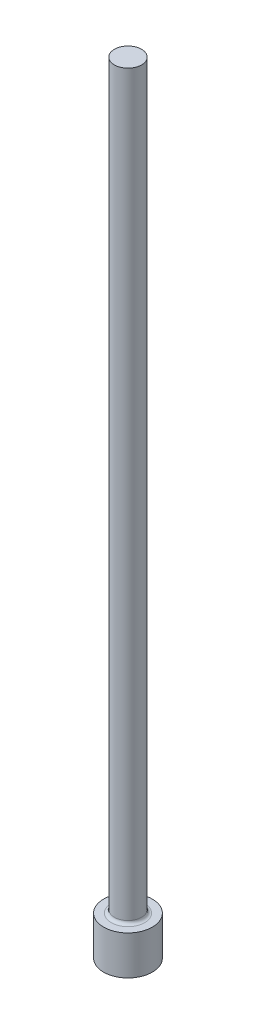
SolidWorks part; units mm, degrees
ref_plane "Front Plane" through (0, 0, 0) normal (0, 0, 1) x (1, 0, 0)
ref_plane "Top Plane" through (0, 0, 0) normal (0, 1, 0) x (1, 0, 0)
ref_plane "Right Plane" through (0, 0, 0) normal (1, 0, 0) x (0, 0, -1)
sketch "Sketch1" plane through (0, 0, 0) normal (0, 0, 1) x (1, 0, 0)
  line L0 (0, 0) -> (0, -1.906) construction
  line L1 (0, 0) -> (1.9812, 0)
  line L2 (1.9812, 0) -> (1.9812, 3.175)
  line L3 (1.9812, 3.175) -> (1.3589, 3.175)
  line L4 (1.1049, 3.429) -> (1.1049, 63.5)
  line L6 (0, 63.5) -> (1.1049, 63.5)
  line L7 (0, 63.5) -> (0, 0)
  arc A0 (1.3589, 3.175) -> (1.1049, 3.429) centre (1.3589, 3.429) cw
  dimension "D5" = 0.254
  dimension "D" = 2.2098
  dimension "H" = 3.9624
  dimension "D4" = 63.5
  dimension "T" = 3.175
revolve "Revolve3" add sketch "Sketch1" angle 360 about L0
